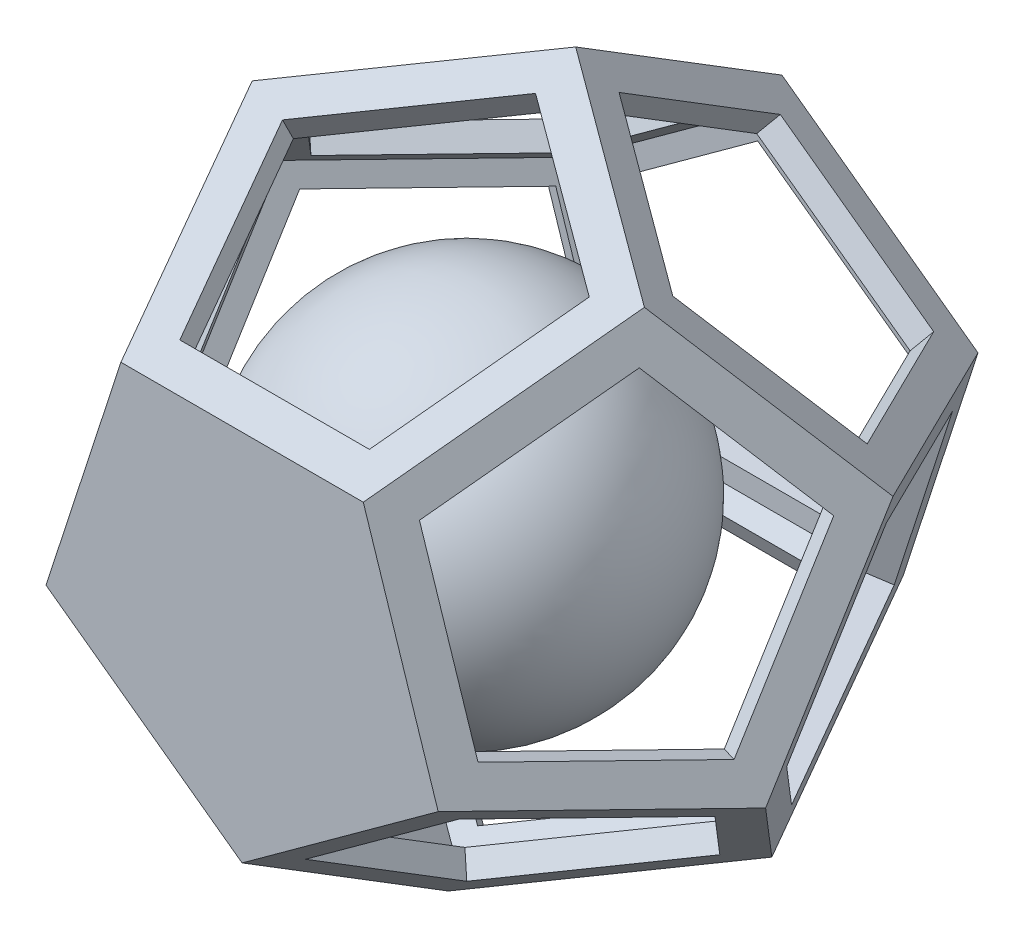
SolidWorks part; units mm, degrees
ref_plane "Front Plane" through (0, 0, 0) normal (0, 0, 1) x (1, 0, 0)
ref_plane "Top Plane" through (0, 0, 0) normal (0, 1, 0) x (1, 0, 0)
ref_plane "Right Plane" through (0, 0, 0) normal (1, 0, 0) x (0, 0, -1)
sketch "Sketch1" plane through (0, 0, 0) normal (0, 0, 1) x (1, 0, 0)
  line L1 (0, 17.013) -> (-16.1803, 5.2573)
  line L2 (-16.1803, 5.2573) -> (-10, -13.7638)
  line L3 (-10, -13.7638) -> (10, -13.7638)
  line L4 (10, -13.7638) -> (16.1803, 5.2573)
  line L5 (16.1803, 5.2573) -> (0, 17.013)
  circle A0 centre (0, 0) radius 13.7638 construction
  dimension "D1" = 20
extrude "Boss-Extrude2" add sketch "Sketch1" along normal blind 44.54 draft 26.57
sketch "Sketch3" plane through (0, 0, 44.54) normal (0, 0, 1) x (1, 0, 0)
  line L0 (-21.183, 29.1559) -> (-10, 13.7638) construction
  line L1 (-10, 13.7638) -> (-16.1803, -5.2573)
  line L2 (-16.1803, -5.2573) -> (0, -17.013)
  line L3 (0, -17.013) -> (16.1803, -5.2573)
  line L4 (16.1803, -5.2573) -> (10, 13.7638)
  line L5 (10, 13.7638) -> (-10, 13.7638)
  line L6 (0, 44.5462) -> (-42.3659, 13.7655) construction
  circle A0 centre (0, 0) radius 13.7638 construction
  dimension "D1" = 20
extrude "Cut-Extrude-Thin1" cut sketch "Sketch3" against normal blind 50 draft 26.57 thin
ref_axis "Axis1" through (0, 0, -2.227) along (0, 0, 1)
shell "Shell1" thickness 2
sketch "Sketch5" plane through (0, 28.8284, 14.4173) normal (0, 0.8944, 0.4473) x (1, 0, 0)
  line L10 (12.6549, -15.8033) -> (0, -6.6106)
  line L11 (0, -6.6106) -> (-12.6549, -15.8033)
  line L12 (-12.6549, -15.8033) -> (-7.8205, -30.6796)
  line L13 (-7.8205, -30.6796) -> (7.8205, -30.6796)
  line L14 (7.8205, -30.6796) -> (12.6549, -15.8033)
  line L15 (12.6549, -15.8033) -> (0, -6.6106)
  line L16 (0, -6.6106) -> (-12.6549, -15.8033)
  line L17 (-12.6549, -15.8033) -> (-7.8205, -30.6796)
  line L18 (-7.8205, -30.6796) -> (7.8205, -30.6796)
  line L19 (7.8205, -30.6796) -> (12.6549, -15.8033)
  dimension "D1" = 3
extrude "Cut-Extrude1" cut sketch "Sketch5" against normal blind 12
pattern_circular "CirPattern1" count 5 over 360 about axis through (0, 0, 0) along (0, 0, 1) of "Cut-Extrude1"
sketch "Sketch6" plane through (-6.4716, 8.9074, -5.5062) normal (-0.5257, 0.7236, -0.4473) x (0.8507, 0.4472, -0.2764)
  line L10 (-10.2689, -31.5988) -> (4.6077, -26.7673)
  line L11 (4.6077, -26.7673) -> (4.6077, -11.1252)
  line L12 (4.6077, -11.1252) -> (-10.2675, -6.2911)
  line L13 (-10.2675, -6.2911) -> (-19.463, -18.9449)
  line L14 (-19.463, -18.9449) -> (-10.2689, -31.5988)
  line L15 (-10.2689, -31.5988) -> (4.6077, -26.7673)
  line L16 (4.6077, -26.7673) -> (4.6077, -11.1252)
  line L17 (4.6077, -11.1252) -> (-10.2675, -6.2911)
  line L18 (-10.2675, -6.2911) -> (-19.463, -18.9449)
  line L19 (-19.463, -18.9449) -> (-10.2689, -31.5988)
  dimension "D1" = 3
extrude "Cut-Extrude2" cut sketch "Sketch6" against normal blind 12
pattern_circular "CirPattern2" count 5 over 360 about axis through (0, 0, 0) along (0, 0, 1) of "Cut-Extrude2"
sketch "Sketch8" plane through (0, 0, 0) normal (0, 1, 0) x (1, 0, 0)
  line L0 (0, 2.227) -> (0, -46.767) construction
  line L1 (13.1589, -42.5403) -> (-12.7267, -42.5403) construction
  line L2 (0, -41.0123) -> (0, -11.0123)
  arc A0 (0, -11.0123) -> (0, -41.0123) centre (0, -26.0123) ccw
  dimension "D1" = 15
revolve "Revolve1" add sketch "Sketch8" angle 360 about axis through (0, 0, -2.227) along (0, 0, 1)
sketch "Sketch9" plane through (0, 0, 0) normal (0, 0, -1) x (-1, 0, 0)
  line L10 (0, 13.3048) -> (-12.6536, 4.1114)
  line L11 (-12.6536, 4.1114) -> (-7.8204, -10.7638)
  line L12 (-7.8204, -10.7638) -> (7.8204, -10.7638)
  line L13 (7.8204, -10.7638) -> (12.6536, 4.1114)
  line L14 (12.6536, 4.1114) -> (0, 13.3048)
  line L15 (0, 13.3048) -> (-12.6536, 4.1114)
  line L16 (-12.6536, 4.1114) -> (-7.8204, -10.7638)
  line L17 (-7.8204, -10.7638) -> (7.8204, -10.7638)
  line L18 (7.8204, -10.7638) -> (12.6536, 4.1114)
  line L19 (12.6536, 4.1114) -> (0, 13.3048)
  dimension "D1" = 3
extrude "Cut-Extrude3" cut sketch "Sketch9" against normal blind 8
